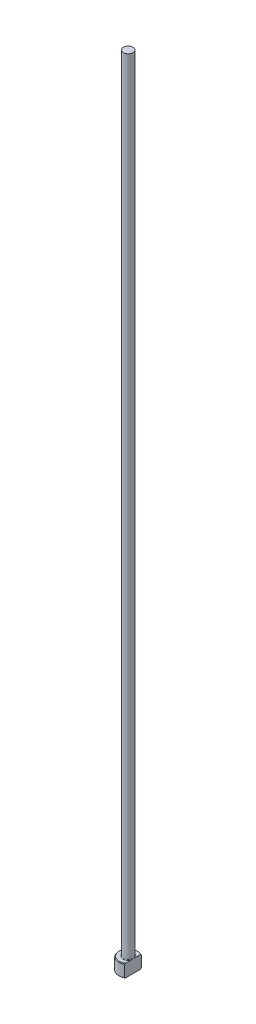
SolidWorks part; units mm, degrees
ref_plane "Front Plane" through (0, 0, 0) normal (0, 0, 1) x (1, 0, 0)
ref_plane "Top Plane" through (0, 0, 0) normal (0, 1, 0) x (1, 0, 0)
ref_plane "Right Plane" through (0, 0, 0) normal (1, 0, 0) x (0, 0, -1)
sketch "Sketch1" plane through (0, 0, 0) normal (0, 0, 1) x (1, 0, 0)
  line L0 (0, 259.9588) -> (0, -15.1925) construction
  line L1 (0, 0) -> (-3, 0)
  line L2 (-3, 0) -> (-3, 4)
  line L3 (-3, 4) -> (-1.5, 4)
  line L4 (-1.5, 4) -> (-1.5, 250)
  line L5 (-1.5, 250) -> (0, 250)
  line L6 (0, 250) -> (0, 0)
  dimension "L" = 250
  dimension "H" = 6
  dimension "T" = 4
  dimension "D" = 3
revolve "Revolve1" add sketch "Sketch1" angle 360 about L0
chamfer "Chamfer1" distance 0.2 angle 45 2 edges at (0, 4, 3) (0, 0, 3)
fillet "Fillet1" radius 0.2 1 edges at (0, 4, 1.5)
sketch "Sketch2" plane through (0, 0, 0) normal (0, 1, 0) x (1, 0, 0)
  line L0 (1.5, -2.5981) -> (1.5, 2.5981)
  circle A0 centre (0, 0) radius 3 construction
  arc A1 (1.5, -2.5981) -> (1.5, 2.5981) centre (0, 0) ccw
  circle A2 centre (0, 0) radius 1.5 construction
extrude "KEYED HEAD" cut sketch "Sketch2" along normal through all
